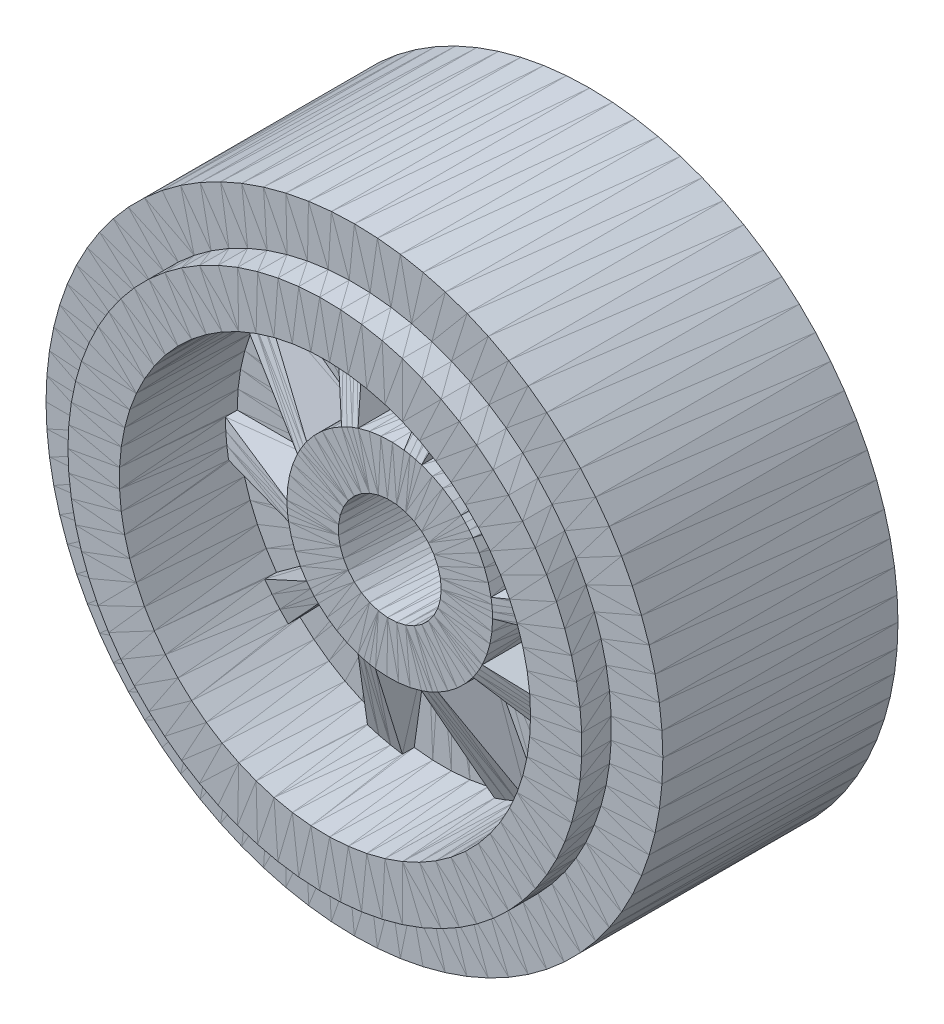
SolidWorks part; units mm, degrees
ref_plane "Front Plane" through (0, 0, 0) normal (0, 0, 1) x (1, 0, 0)
ref_plane "Top Plane" through (0, 0, 0) normal (0, 1, 0) x (1, 0, 0)
ref_plane "Right Plane" through (0, 0, 0) normal (1, 0, 0) x (0, 0, -1)
imported_body "Rim(1).step<1>"
scale "Scale1" scale about origin uniform scaling no x scale factor 0.174417 y scale factor 0.174417 z scale factor 0.1
